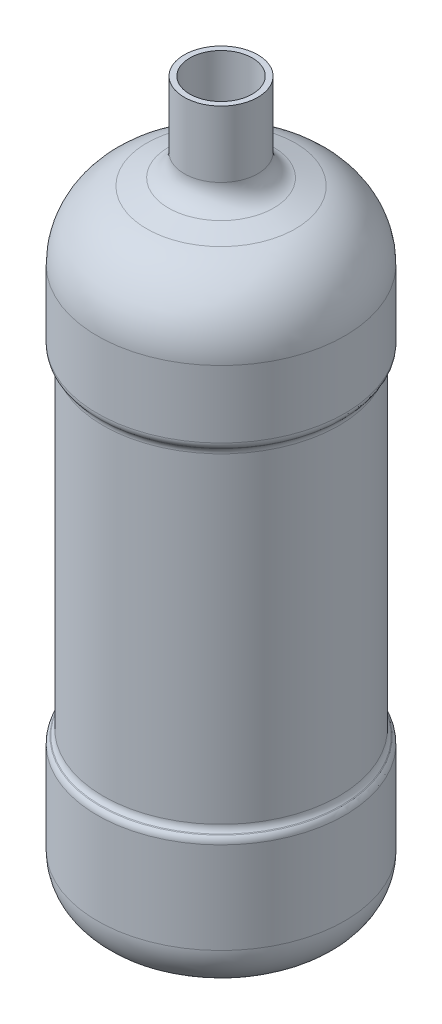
SolidWorks part; units mm, degrees
ref_plane "Front Plane" through (0, 0, 0) normal (0, 0, 1) x (1, 0, 0)
ref_plane "Top Plane" through (0, 0, 0) normal (0, 1, 0) x (1, 0, 0)
ref_plane "Right Plane" through (0, 0, 0) normal (1, 0, 0) x (0, 0, -1)
sketch "Sketch1" plane through (0, 0, 0) normal (0, 0, 1) x (1, 0, 0)
  line L0 (0, 0) -> (0, 213.5366) construction
  line L1 (0, 0) -> (21.436, 0)
  line L2 (34.136, 12.7) -> (34.136, 37.9392)
  line L3 (20.5248, 171.3212) -> (14.5271, 173.2927)
  line L4 (10.16, 179.3252) -> (10.16, 197.5882)
  line L5 (10.16, 197.5882) -> (0, 197.5882)
  line L6 (0, 197.5882) -> (0, 0)
  line L7 (33.3921, 132.2025) -> (33.2307, 132.0412)
  line L8 (32.4868, 130.2451) -> (32.4868, 41.6927)
  line L9 (33.2307, 39.8966) -> (33.3921, 39.7353)
  line L10 (34.136, 133.9986) -> (34.136, 152.5192)
  arc A0 (34.136, 152.5192) -> (20.5248, 171.3212) centre (14.3443, 152.5192) ccw
  arc A1 (14.5271, 173.2927) -> (10.16, 179.3252) centre (16.51, 179.3252) cw
  arc A2 (33.3921, 132.2025) -> (34.136, 133.9986) centre (31.596, 133.9986) ccw
  arc A3 (33.2307, 132.0412) -> (32.4868, 130.2451) centre (35.0268, 130.2451) ccw
  arc A4 (32.4868, 41.6927) -> (33.2307, 39.8966) centre (35.0268, 41.6927) ccw
  arc A5 (33.3921, 39.7353) -> (34.136, 37.9392) centre (31.596, 37.9392) cw
  arc A6 (21.436, 0) -> (34.136, 12.7) centre (21.436, 12.7) ccw
  point P16 (10.16, 174.7282)
  point P19 (34.136, 132.9465)
  dimension "D3" = 6.35
  dimension "D4" = 2.54
  dimension "D5" = 12.7
  dimension "D1" = 20.32
  dimension "D2" = 22.86
revolve "Revolve1" add sketch "Sketch1" angle 360 about L0
shell "Shell1" thickness 1.016
